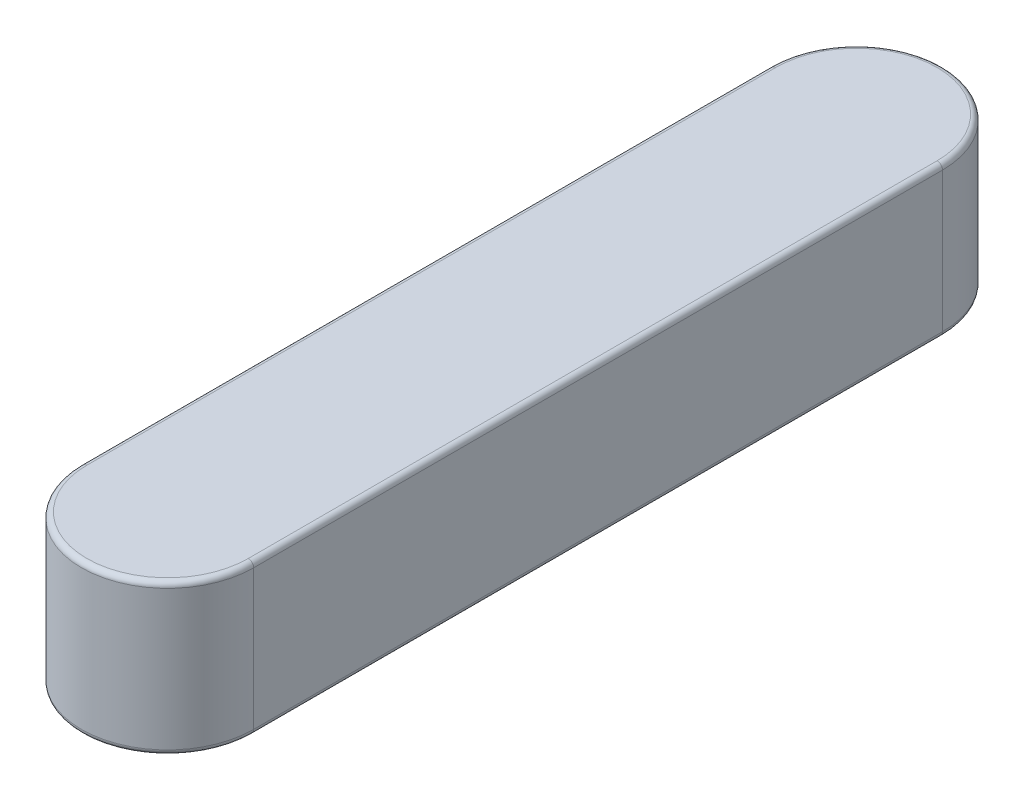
SolidWorks part; units mm, degrees
ref_plane "Plan de face" through (0, 0, 0) normal (0, 0, 1) x (1, 0, 0)
ref_plane "Plan de dessus" through (0, 0, 0) normal (0, 1, 0) x (1, 0, 0)
ref_plane "Plan de droite" through (0, 0, 0) normal (1, 0, 0) x (0, 0, -1)
sketch "Esquisse1" plane through (0, 0, 0) normal (0, 1, 0) x (1, 0, 0)
  line L0 (0, 32) -> (0, 39.5) construction
  line L1 (4, 32) -> (4, 0)
  line L2 (-4, 0) -> (-4, 32)
  arc A0 (4, 32) -> (-4, 32) centre (0, 32) ccw
  arc A1 (-4, 0) -> (4, 0) centre (0, 0) ccw
  dimension "D1" = 8
  dimension "D2" = 32
  dimension "D3" = 7.5
extrude "Extrusion1" add sketch "Esquisse1" along normal blind 7
fillet "Congé1" radius 0.25 8 edges at (-4, 0, -16) (0, 0, -36) (4, 0, -16) (-4, 7, -16) (0, 7, -36) (4, 7, -16) (0, 0, 4) (0, 7, 4)
